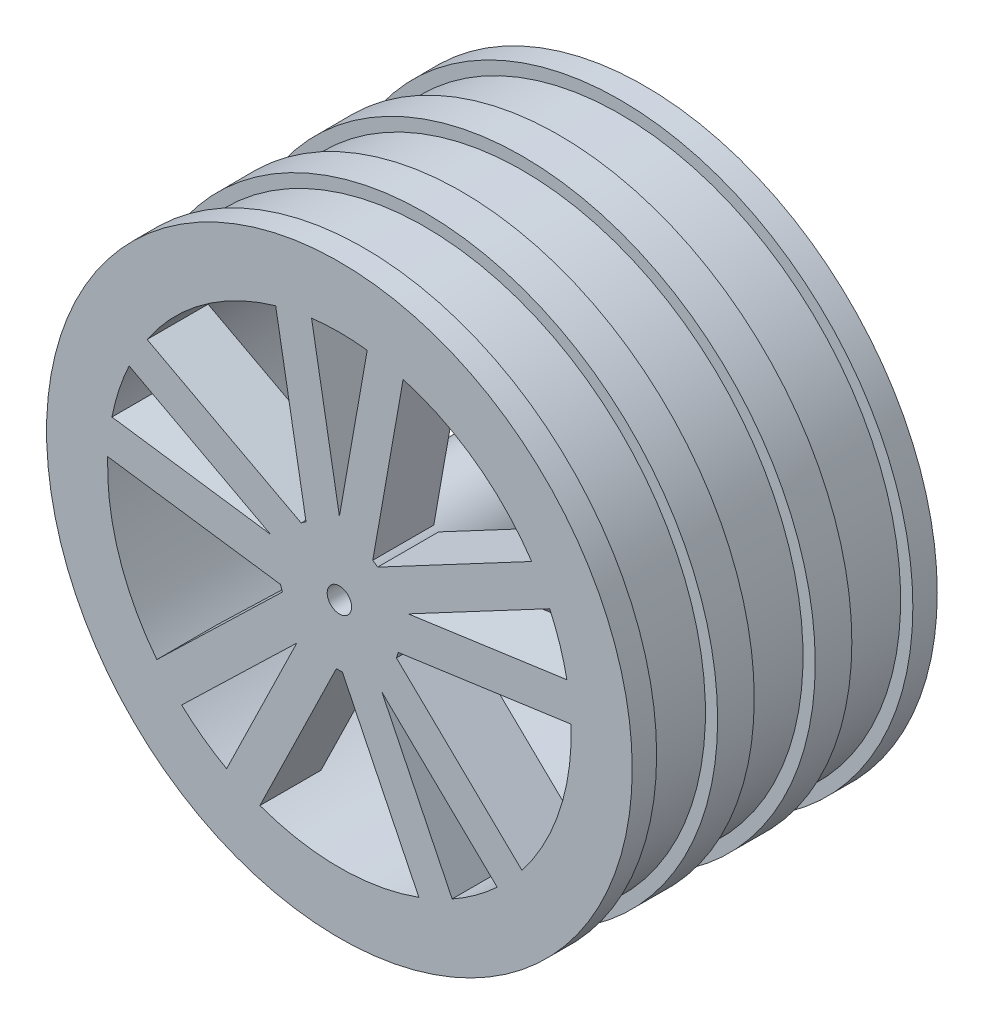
SolidWorks part; units mm, degrees
ref_plane "Front Plane" through (0, 0, 0) normal (0, 0, 1) x (1, 0, 0)
ref_plane "Top Plane" through (0, 0, 0) normal (0, 1, 0) x (1, 0, 0)
ref_plane "Right Plane" through (0, 0, 0) normal (1, 0, 0) x (0, 0, -1)
sketch "Sketch2" plane through (0, 0, 0) normal (1, 0, 0) x (0, 0, -1)
  line L0 (-29.6681, 0) -> (43.8939, 0) construction
  line L1 (55, 0) -> (-55, 0) construction
  line L2 (0, 55) -> (0, -55) construction
  line L3 (-12.5, 19) -> (12.5, 19)
  line L4 (-12.5, 19) -> (-12.5, 24)
  line L5 (-12.5, 24) -> (12.5, 24)
  line L6 (12.5, 19) -> (12.5, 24)
  point P9 (0, 24)
  dimension "D1" = 25
  dimension "D2" = 5
  dimension "D3" = 24
revolve "Revolve1" add sketch "Sketch2" angle 360 about L0
ref_axis "Axis1" through (0, 0, -62.6231) along (0, 0, 1)
ref_plane "Plane1" through (0, 0, 12.5) normal (0, 0, 1) x (1, 0, 0)
sketch "Sketch3" plane through (0, 0, 12.5) normal (0, 0, 1) x (1, 0, 0)
  line L0 (-2, 0) -> (-6.0932, 23.2136)
  line L1 (55, 0) -> (-55, 0) construction
  line L2 (2, 0) -> (6.0932, 23.2136)
  line L3 (0, 32.0164) -> (0, -37.2754) construction
  line L4 (0, -55) -> (0, 55) construction
  line L5 (-2, 0) -> (2, 0)
  line L6 (0, 5.9337) -> (0, 5.9337)
  line L7 (0, 5.9337) -> (2.6275, 20.835)
  line L8 (0, 5.9337) -> (-2.6275, 20.835)
  circle A2 centre (0, 0) radius 24 construction
  arc A3 (-6.0932, 23.2136) -> (6.0932, 23.2136) centre (0, 0) cw
  arc A4 (-2.6275, 20.835) -> (2.6275, 20.835) centre (0, 0) cw
  dimension "D1" = 20
  dimension "D2" = 4
  dimension "D3" = 3
extrude "Boss-Extrude1" add sketch "Sketch3" against normal blind 5 contours L3 A3 L0 L5 L8 A4 | A3 L3 A4 L7 L5 L2
pattern_circular "CirPattern1" count 5 over 360 about axis through (0, 0, 0) along (0, 0, 1) of "Boss-Extrude1"
mirror "Mirror1" about plane through (0, 0, 0) normal (0, 0, 1) of "CirPattern1", "Boss-Extrude1"
sketch "Sketch4" plane through (0, 0, 12.5) normal (0, 0, 1) x (1, 0, 0)
  circle A0 centre (0, 0) radius 5
  dimension "D1" = 10
extrude "Boss-Extrude2" add sketch "Sketch4" against normal up to surface (25 mm away)
sketch "Sketch5" plane through (0, 0, 12.5) normal (0, 0, 1) x (1, 0, 0)
  circle A0 centre (0, 0) radius 1
  dimension "D1" = 2
extrude "Cut-Extrude1" cut sketch "Sketch5" against normal through all
sketch "Sketch6" plane through (0, 0, 0) normal (1, 0, 0) x (0, 0, -1)
  line L0 (-12.5, 24) -> (-12.5, -24) construction
  line L1 (-10.5, 23) -> (-5.5, 23)
  line L2 (-10.5, 23) -> (-10.5, 25)
  line L3 (-10.5, 25) -> (-5.5, 25)
  line L4 (-5.5, 23) -> (-5.5, 25)
  line L5 (12.5, 24) -> (-12.5, 24) construction
  line L6 (-2.5, 23) -> (-2.5, 25)
  line L7 (-2.5, 23) -> (2.5, 23)
  line L8 (2.5, 23) -> (2.5, 25)
  line L9 (-2.5, 25) -> (2.5, 25)
  line L18 (5.5, 23) -> (5.5, 25)
  line L19 (5.5, 23) -> (10.5, 23)
  line L20 (10.5, 23) -> (10.5, 25)
  line L21 (5.5, 25) -> (10.5, 25)
  point P6 (-10.5, 24)
  dimension "D1" = 5
  dimension "D2" = 2
  dimension "D3" = 2
  dimension "D4" = 3
revolve "Cut-Revolve1" cut sketch "Sketch6" angle 360 about axis through (0, 0, -62.6231) along (0, 0, 1)
